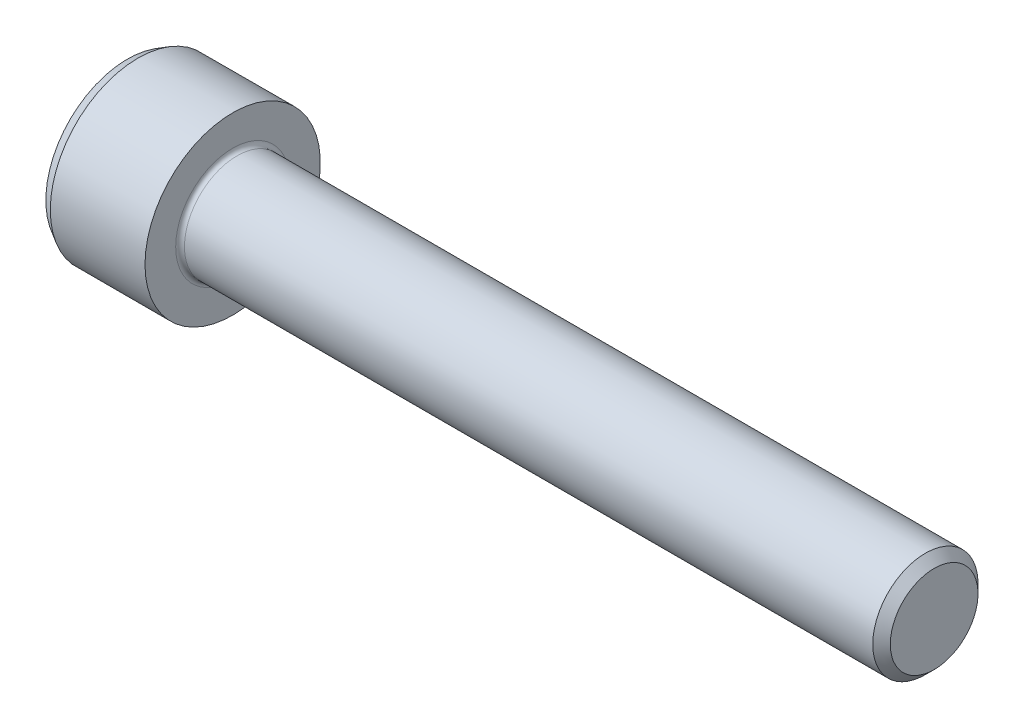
SolidWorks part; units mm, degrees
ref_plane "Front" through (0, 0, 0) normal (0, 0, 1) x (1, 0, 0)
ref_plane "Top" through (0, 0, 0) normal (0, 1, 0) x (1, 0, 0)
ref_plane "Right" through (0, 0, 0) normal (1, 0, 0) x (0, 0, -1)
sketch "Sketch1" plane through (0, 0, 0) normal (0, 0, 1) x (1, 0, 0)
  line L0 (40, 0) -> (40, 3)
  line L1 (40, 3) -> (0, 3)
  line L2 (0, 3) -> (0, 5)
  line L3 (0, 5) -> (-6, 5)
  line L4 (-6, 5) -> (-6, 0)
  line L5 (-6, 0) -> (40, 0)
  line L6 (-24.6844, 0) -> (40.7162, 0) construction
  dimension "k" = 6
  dimension "l" = 40
  dimension "dk" = 10
  dimension "d" = 6
revolve "Revolve1" add sketch "Sketch1" angle 360 about L6
sketch "Sketch2" plane through (0, 0, 0) normal (0, 0, 1) x (1, 0, 0)
  line L0 (-6, 2.5) -> (-3, 2.5)
  line L1 (-3, 2.5) -> (-1.5566, 0)
  line L2 (-1.5566, 0) -> (-6, 0)
  line L3 (-6, 0) -> (-6, 2.5)
  line L4 (-13.1818, 0) -> (4.0086, 0) construction
  line L5 (-6, 5) -> (-6, -5) construction
  dimension "s" = 5
  dimension "t" = 3
  dimension "D3" = 60
revolve "Cut-Revolve1" cut sketch "Sketch2" angle 360 about L2
sketch "Sketch3" plane through (-6, 0, 0) normal (1, 0, 0) x (0, 0, -1)
  line L1 (0, 2.8868) -> (-2.5, 1.4434)
  line L2 (-2.5, 1.4434) -> (-2.5, -1.4434)
  line L3 (-2.5, -1.4434) -> (0, -2.8868)
  line L4 (0, -2.8868) -> (2.5, -1.4434)
  line L5 (2.5, -1.4434) -> (2.5, 1.4434)
  line L6 (2.5, 1.4434) -> (0, 2.8868)
  circle A0 centre (0, 0) radius 2.5 construction
  circle A2 centre (0, 0) radius 2.5 construction
extrude "Cut-Extrude1" cut sketch "Sketch3" along normal up to surface (2.7767 mm away)
sketch "Sketch5" plane through (0, 0, 0) normal (0, 0, 1) x (1, 0, 0)
  line L0 (-6, 2.8868) -> (-6, 0)
  line L1 (-6, 0) -> (-4.3333, 0)
  line L2 (-4.3333, 0) -> (-6, 2.8868)
  dimension "D1" = 30
revolve "Cut-Revolve2" cut sketch "Sketch5" angle 360 about L1
chamfer "Chamfer1" distance 0.6 angle 30 1 edges at (-6, 0, 5)
fillet "Fillet1" radius 0.25 1 edges at (0, 0, 3)
chamfer "Chamfer2" distance 0.5 angle 45 1 edges at (40, 0, 3)
